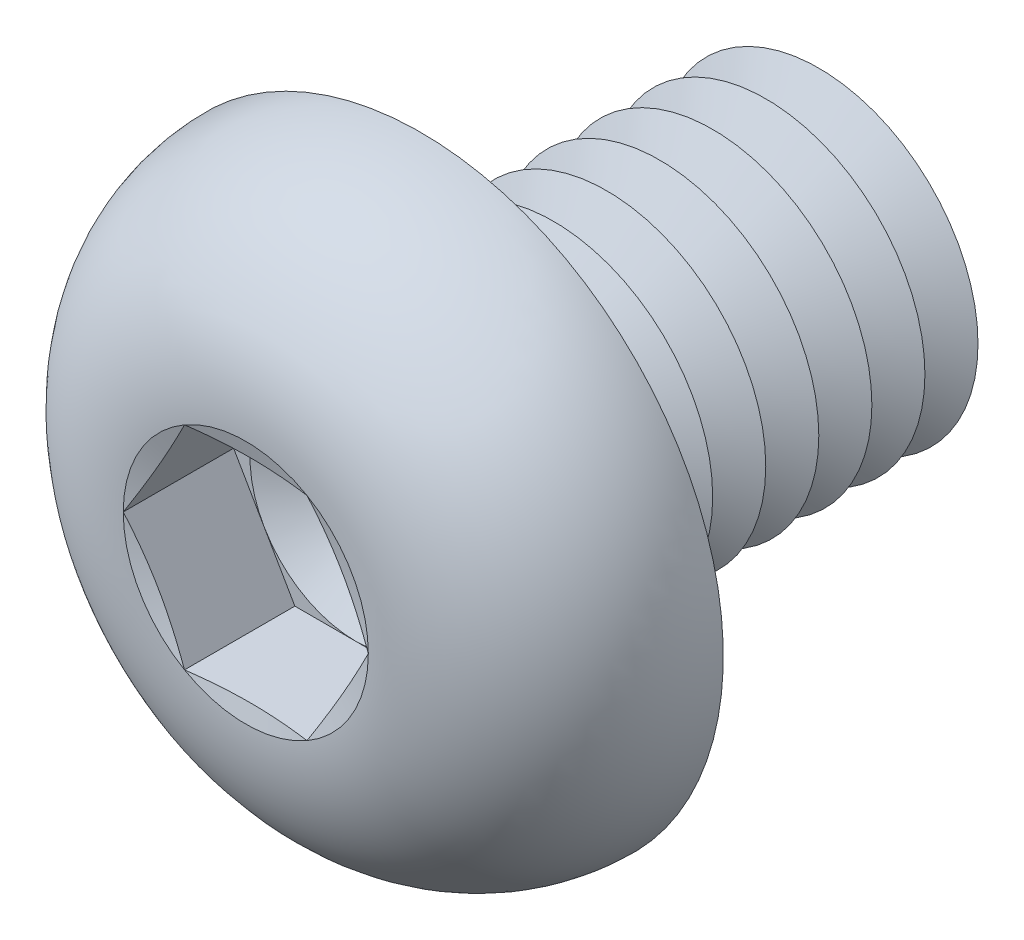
SolidWorks part; units mm, degrees
ref_plane "Front Plane" through (0, 0, 0) normal (0, 0, 1) x (1, 0, 0)
ref_plane "Top Plane" through (0, 0, 0) normal (0, 1, 0) x (1, 0, 0)
ref_plane "Right Plane" through (0, 0, 0) normal (1, 0, 0) x (0, 0, -1)
sketch "Sketch1" plane through (0, 0, 0) normal (1, 0, 0) x (0, 0, -1)
  line L0 (0, 1.5) -> (0, 2.85)
  line L3 (0, 1.5) -> (4, 1.5)
  line L4 (4, 1.5) -> (4, 0)
  line L5 (4, 0) -> (-1.65, 0) construction
  line L6 (-1.65, 0) -> (4, 0)
  line L7 (-1.65, 1.1547) -> (-1.65, 0.5773) construction
  line L8 (-1.65, 0.5773) -> (-1.65, 0)
  line L9 (-1.65, 1.1547) -> (-1.4953, 0.5773)
  line L10 (-1.4953, 0.5773) -> (-1.65, 0.5773)
  line L11 (4, 0) -> (22.7481, 0) construction
  line L12 (0, 2.85) -> (-1.65, 2.85) construction
  arc A1 (0, 2.85) -> (-1.65, 1.1547) centre (0, 1.1994) ccw
  point P8 (4, 0.75)
  dimension "D1" = 5.7
  dimension "D2" = 3
  dimension "D3" = 1.65
  dimension "D4" = 2.3094
  dimension "D5" = 4
  dimension "D6" = 15
revolve "Revolve1" add sketch "Sketch1" angle 360 about L5
fillet "Fillet1" radius 0.25 1 edges at (-1.5, 0, 0)
sketch "Sketch2" plane through (0, 0, 0) normal (1, 0, 0) x (0, 0, -1)
  line L0 (3.75, 1.5) -> (4.25, 1.5)
  line L1 (4, 1.5) -> (0.25, 1.5) construction
  line L2 (4.25, 1.5) -> (4, 1.067)
  line L3 (4, -1.5) -> (4, 1.5) construction
  line L4 (4, 1.067) -> (3.75, 1.5)
  dimension "D1" = 0.5
revolve "Cut-Revolve1" cut sketch "Sketch2" angle 360 about axis through (0, 0, -4) along (0, 0, -1)
pattern_linear "LPattern1" count 8 spacing 0.5 along (0, 0, 1) of "Cut-Revolve1"
sketch "Sketch3" plane through (0, 0, 1.65) normal (0, 0, 1) x (1, 0, 0)
  line L7 (0.5773, 1) -> (-0.5774, 1)
  line L8 (-0.5774, 1) -> (-1.1547, 0)
  line L9 (-1.1547, 0) -> (-0.5773, -1)
  line L10 (-0.5773, -1) -> (0.5773, -1)
  line L11 (0.5773, -1) -> (1.1547, 0)
  line L12 (1.1547, 0) -> (0.5773, 1)
  circle A0 centre (0, 0) radius 1 construction
  circle A3 centre (0, 0) radius 1.1547 construction
extrude "Cut-Extrude1" cut sketch "Sketch3" against normal blind 1.04
sketch "Sketch4" plane through (0, 0, 0.61) normal (0, 0, 1) x (1, 0, 0)
  line L1 (0.5773, 1) -> (-0.5774, 1) construction
  circle A0 centre (0, 0) radius 1
extrude "Cut-Extrude2" cut sketch "Sketch4" against normal through all draft 60
